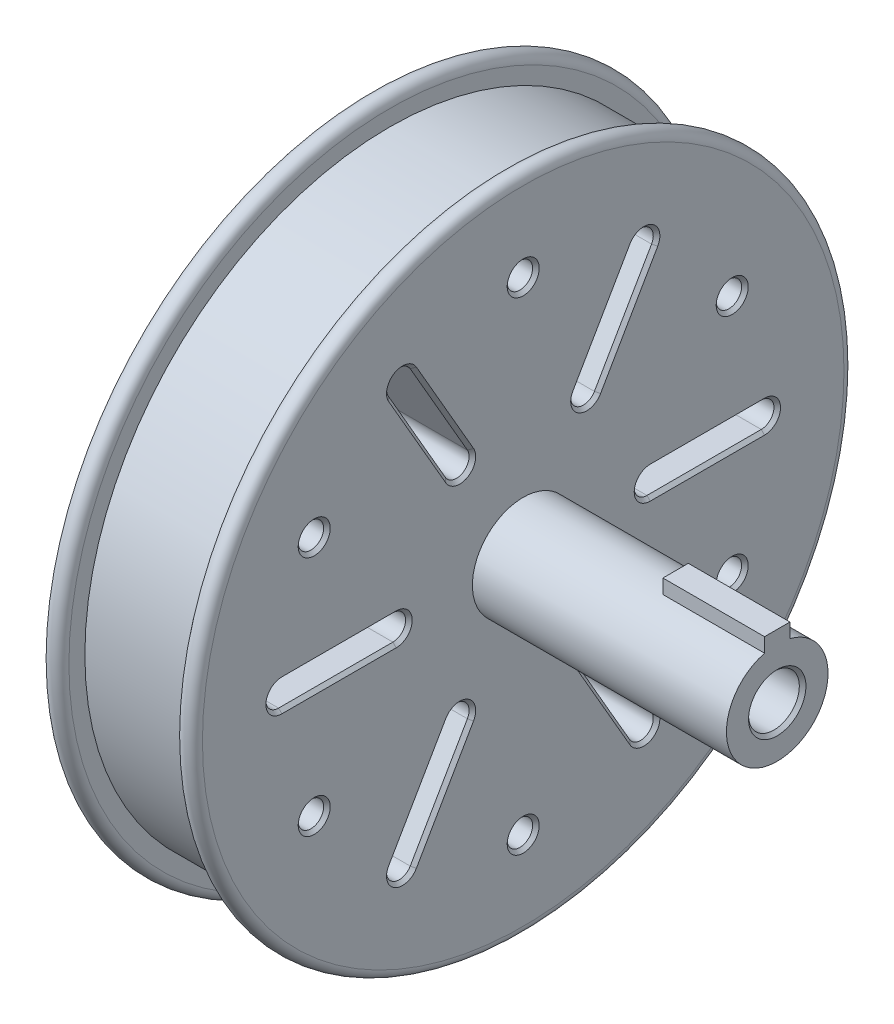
SolidWorks part; units mm, degrees
ref_plane "Front Plane" through (0, 0, 0) normal (0, 0, 1) x (1, 0, 0)
ref_plane "Top Plane" through (0, 0, 0) normal (0, 1, 0) x (1, 0, 0)
ref_plane "Right Plane" through (0, 0, 0) normal (1, 0, 0) x (0, 0, -1)
sketch "Sketch1" plane through (0, 0, 0) normal (0, 0, 1) x (1, 0, 0)
  line L0 (0, 0) -> (-81.3733, 0) construction
  line L1 (63.5, 12.7) -> (0, 12.7)
  line L2 (207.9625, 12.7) -> (58.7375, 12.7) construction
  line L3 (0, 23.8125) -> (0, -23.8125) construction
  line L4 (0, 12.7) -> (0, 80.1878)
  line L5 (-4.7244, 80.1878) -> (-4.7244, 76.2)
  line L6 (-4.7244, 76.2) -> (-33.3756, 76.2)
  line L7 (-33.3756, 76.2) -> (-33.3756, 80.1878)
  line L8 (-38.1, 80.1878) -> (-38.1, 23.8125)
  line L9 (-38.1, 23.8125) -> (-36.5125, 22.225)
  line L10 (-36.5125, 22.225) -> (-19.05, 22.225)
  line L11 (-19.05, 22.225) -> (-19.05, 6.35)
  line L16 (-19.05, 6.35) -> (63.5, 6.35)
  line L17 (63.5, 6.35) -> (63.5, 12.7)
  arc A0 (-4.7244, 80.1878) -> (0, 80.1878) centre (-2.3622, 80.1878) cw
  arc A1 (-33.3756, 80.1878) -> (-38.1, 80.1878) centre (-35.7378, 80.1878) ccw
  dimension "D2" = 2.3622
  dimension "D3" = 165.1
  dimension "D1" = 38.1
  dimension "D4" = 152.4
  dimension "D5" = 44.45
  dimension "D6" = 45
  dimension "D7" = 1.5875
  dimension "D8" = 19.05
  dimension "D9" = 101.6
  dimension "D10" = 12.7
revolve "Revolve1" add sketch "Sketch1" angle 360 about L0
sketch "Sketch2" plane through (63.5, 0, 0) normal (1, 0, 0) x (0, 0, -1)
  line L0 (0, 0) -> (0, 21.7452) construction
  line L1 (-3.175, 12.2967) -> (-3.175, 15.875)
  line L2 (3.175, 12.2967) -> (3.175, 15.875)
  line L3 (-3.175, 15.875) -> (3.175, 15.875)
  circle A0 centre (0, 0) radius 12.7 construction
  arc A1 (3.175, 12.2967) -> (-3.175, 12.2967) centre (0, 0) ccw
  point P7 (0, 15.875)
  dimension "D1" = 15.875
  dimension "D2" = 6.35
extrude "Extrude1" add sketch "Sketch2" against normal blind 25.4
sketch "Sketch3" plane through (-38.1, 0, 0) normal (-1, 0, 0) x (0, 0, 1)
  circle A0 centre (0, 0) radius 60.325 construction
  circle A1 centre (0, 60.325) radius 3.175
  circle A2 centre (52.243, 30.1625) radius 3.175
  circle A3 centre (52.243, -30.1625) radius 3.175
  circle A4 centre (0, -60.325) radius 3.175
  circle A5 centre (-52.243, -30.1625) radius 3.175
  circle A6 centre (-52.243, 30.1625) radius 3.175
  dimension "D1" = 120.65
  dimension "D2" = 6.35
extrude "Cut-Extrude1" cut sketch "Sketch3" against normal through all
sketch "Sketch4" plane through (0, 0, 0) normal (1, 0, 0) x (0, 0, -1)
  line L0 (15.875, 27.4963) -> (30.1625, 52.243) construction
  line L1 (0, 0) -> (0, 80.1878) construction
  line L2 (30.1625, 52.243) -> (0, 0) construction
  line L3 (18.6246, 25.9088) -> (32.9121, 50.6555)
  line L4 (13.1254, 29.0838) -> (27.4129, 53.8305)
  line L5 (31.75, -3.175) -> (60.325, -3.175)
  line L6 (31.75, 3.175) -> (60.325, 3.175)
  line L7 (31.75, 0) -> (60.325, 0) construction
  line L8 (13.1254, -29.0838) -> (27.4129, -53.8305)
  line L9 (18.6246, -25.9088) -> (32.9121, -50.6555)
  line L10 (15.875, -27.4963) -> (30.1625, -52.243) construction
  line L11 (-18.6246, -25.9088) -> (-32.9121, -50.6555)
  line L12 (-13.1254, -29.0838) -> (-27.4129, -53.8305)
  line L13 (-15.875, -27.4963) -> (-30.1625, -52.243) construction
  line L14 (-31.75, 3.175) -> (-60.325, 3.175)
  line L15 (-31.75, -3.175) -> (-60.325, -3.175)
  line L16 (-31.75, 0) -> (-60.325, 0) construction
  line L17 (-13.1254, 29.0838) -> (-27.4129, 53.8305)
  line L18 (-18.6246, 25.9088) -> (-32.9121, 50.6555)
  line L19 (-15.875, 27.4963) -> (-30.1625, 52.243) construction
  circle A0 centre (0, 0) radius 80.1878 construction
  circle A1 centre (0, 0) radius 60.325 construction
  arc A2 (18.6246, 25.9088) -> (13.1254, 29.0838) centre (15.875, 27.4963) cw
  arc A3 (32.9121, 50.6555) -> (27.4129, 53.8305) centre (30.1625, 52.243) ccw
  arc A4 (31.75, -3.175) -> (31.75, 3.175) centre (31.75, 0) cw
  arc A5 (60.325, -3.175) -> (60.325, 3.175) centre (60.325, 0) ccw
  arc A6 (13.1254, -29.0838) -> (18.6246, -25.9088) centre (15.875, -27.4963) cw
  arc A7 (27.4129, -53.8305) -> (32.9121, -50.6555) centre (30.1625, -52.243) ccw
  arc A8 (-18.6246, -25.9088) -> (-13.1254, -29.0838) centre (-15.875, -27.4963) cw
  arc A9 (-32.9121, -50.6555) -> (-27.4129, -53.8305) centre (-30.1625, -52.243) ccw
  arc A10 (-31.75, 3.175) -> (-31.75, -3.175) centre (-31.75, 0) cw
  arc A11 (-60.325, 3.175) -> (-60.325, -3.175) centre (-60.325, 0) ccw
  arc A12 (-13.1254, 29.0838) -> (-18.6246, 25.9088) centre (-15.875, 27.4963) cw
  arc A13 (-27.4129, 53.8305) -> (-32.9121, 50.6555) centre (-30.1625, 52.243) ccw
  dimension "D5" = 120.65
  dimension "D1" = 30
  dimension "D2" = 28.575
  dimension "D3" = 3.175
  dimension "D4" = 3.175
extrude "Cut-Extrude2" cut sketch "Sketch4" against normal through all
chamfer "Chamfer1" distance 0.8255 angle 45 61 edges at (-38.1, -30.1625, 55.418) (0, -30.1625, 49.068) (-38.1, -60.325, 3.175) (0, -60.325, -3.175) (-38.1, -30.1625, -49.068) (0, -30.1625, -55.418) (-38.1, 30.1625, -49.068) (0, 30.1625, -55.418) (-38.1, 60.325, 3.175) (0, 60.325, -3.175) (-38.1, 30.1625, 55.418) (0, 30.1625, 49.068) (-38.1, -41.4571, 20.2691) (-38.1, -24.7467, 14.2875) (-38.1, -54.9926, 31.75) (-38.1, -38.2821, 25.7684) (-38.1, -3.175, 46.0375) (-38.1, 0, 28.575) (-38.1, 0, 63.5) (-38.1, 3.175, 46.0375) (-38.1, 38.2821, 25.7684) (-38.1, 24.7467, 14.2875) (-38.1, 54.9926, 31.75) (-38.1, 41.4571, 20.2691) (-38.1, 41.4571, -20.2691) (-38.1, 24.7467, -14.2875) (-38.1, 54.9926, -31.75) (-38.1, 38.2821, -25.7684) (-38.1, 3.175, -46.0375) (-38.1, 0, -28.575) (-38.1, 0, -63.5) (-38.1, -3.175, -46.0375) (-38.1, -38.2821, -25.7684) (-38.1, -24.7467, -14.2875) (-38.1, -54.9926, -31.75) (-38.1, -41.4571, -20.2691) (63.5, 0, -6.35) (0, -41.4571, 20.2691) (0, -24.7467, 14.2875) (0, -54.9926, 31.75) (0, -38.2821, 25.7684) (0, -38.2821, -25.7684) (0, -24.7467, -14.2875) (0, -54.9926, -31.75) (0, -41.4571, -20.2691) (0, -3.175, -46.0375) (0, 0, -63.5) (0, 0, -28.575) (0, 3.175, -46.0375) (0, 38.2821, -25.7684) (0, 54.9926, -31.75) (0, 24.7467, -14.2875) (0, 41.4571, -20.2691) (0, 41.4571, 20.2691) (0, 54.9926, 31.75) (0, 24.7467, 14.2875) (0, 38.2821, 25.7684) (0, 3.175, 46.0375) (0, 0, 63.5) (0, 0, 28.575) (0, -3.175, 46.0375)
